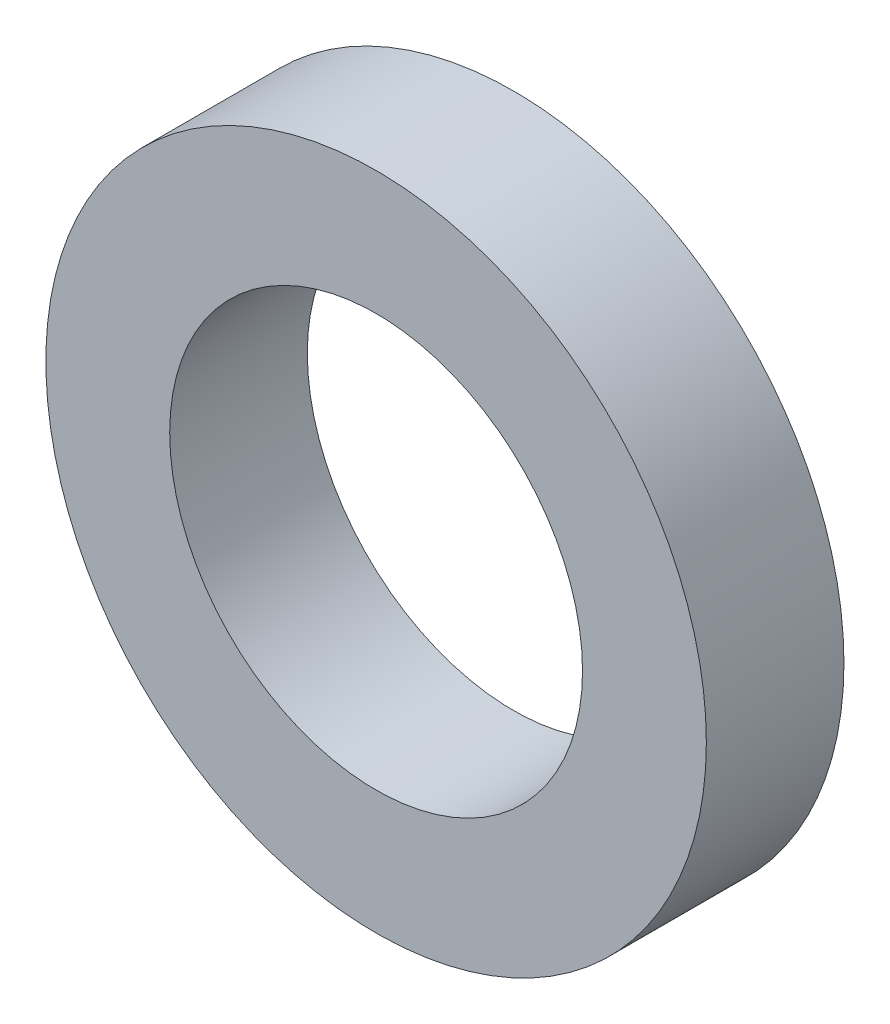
SolidWorks part; units mm, degrees
ref_plane "Front Plane" through (0, 0, 0) normal (0, 0, 1) x (1, 0, 0)
ref_plane "Top Plane" through (0, 0, 0) normal (0, 1, 0) x (1, 0, 0)
ref_plane "Right Plane" through (0, 0, 0) normal (1, 0, 0) x (0, 0, -1)
sketch "Sketch1" plane through (0, 0, 0) normal (0, 0, 1) x (1, 0, 0)
  circle A0 centre (0, 0) radius 7.5
  circle A1 centre (0, 0) radius 12
  dimension "D1" = 24
  dimension "D2" = 15
extrude "Boss-Extrude1" add sketch "Sketch1" along normal blind 5
